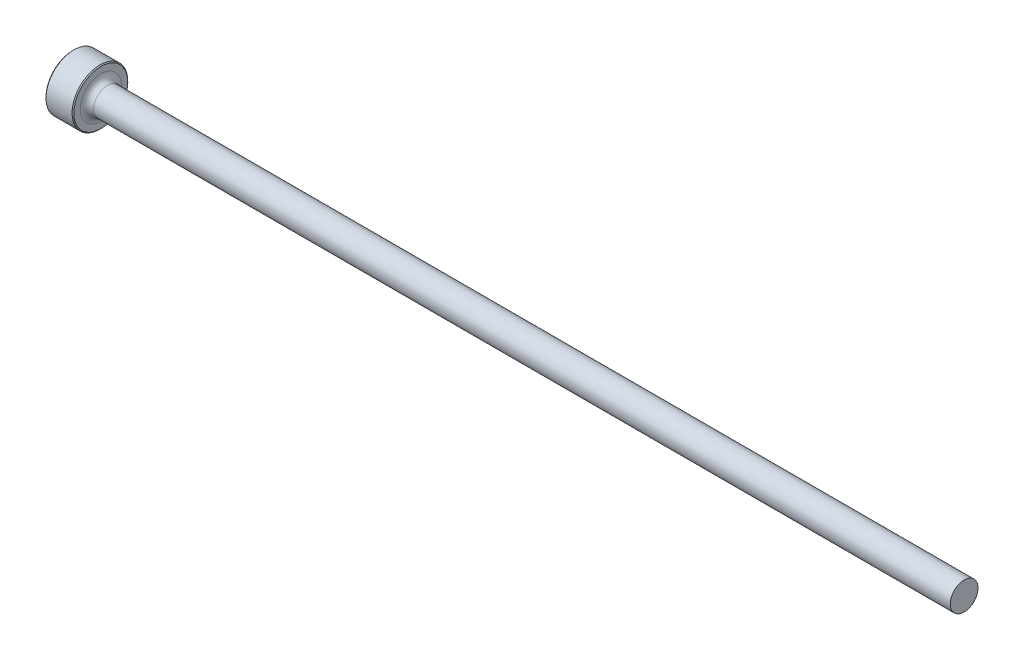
SolidWorks part; units mm, degrees
ref_plane "Front Plane" through (0, 0, 0) normal (0, 0, 1) x (1, 0, 0)
ref_plane "Top Plane" through (0, 0, 0) normal (0, 1, 0) x (1, 0, 0)
ref_plane "Right Plane" through (0, 0, 0) normal (1, 0, 0) x (0, 0, -1)
sketch "Sketch1" plane through (0, 0, 0) normal (0, 0, 1) x (1, 0, 0)
  line L0 (0, 0) -> (0, 3.175)
  line L1 (0, 3.175) -> (3.175, 3.175)
  line L2 (3.175, 3.175) -> (3.175, 2.3457)
  line L3 (3.937, 1.5837) -> (101.6, 1.5837)
  line L4 (101.6, 1.5837) -> (101.6, 0)
  line L5 (101.6, 0) -> (0, 0)
  line L6 (101.6, 0) -> (101.6, -1.5837) construction
  line L7 (101.6, -1.5837) -> (3.175, -1.5837) construction
  line L8 (0, 0) -> (0, -3.175) construction
  line L9 (0, -3.175) -> (3.175, -3.175) construction
  line L10 (3.175, -3.175) -> (3.175, -1.5837) construction
  arc A0 (3.175, 2.3457) -> (3.937, 1.5837) centre (3.937, 2.3457) ccw
  dimension "D4" = 0.762
  dimension "L" = 101.6
  dimension "D" = 3.1674
  dimension "H" = 6.35
  dimension "T" = 3.175
revolve "Revolve1" add sketch "Sketch1" angle 360 about L5
chamfer "Chamfer1" distance 0.1016 angle 45 2 edges at (0, 3.175, 0) (3.175, 3.175, 0)
